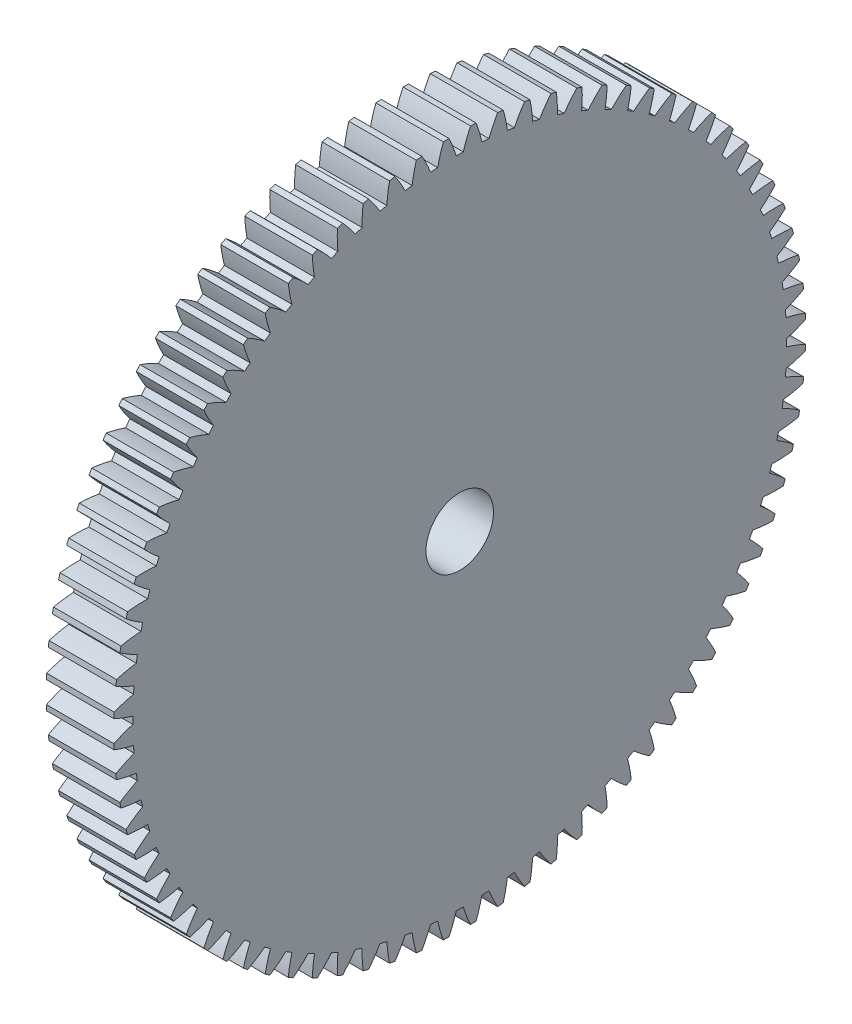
SolidWorks part; units mm, degrees
ref_plane "Plane1" through (0, 0, 0) normal (0, 0, 1) x (1, 0, 0)
ref_plane "Plane2" through (0, 0, 0) normal (0, 1, 0) x (1, 0, 0)
ref_plane "Plane3" through (0, 0, 0) normal (1, 0, 0) x (0, 0, -1)
sketch "HoldingSke" plane through (0, 0, 0) normal (0, 1, 0) x (1, 0, 0)
  line L0 (0, 0) -> (0.3473, -1.9696)
  line L1 (-15, 0) -> (100, 0) construction
  line L2 (0, 0) -> (-2.1039, 2.3779)
  line L3 (0, 0) -> (-11.863, 4.5341)
  line L4 (0, 0) -> (1.4996, 8.5048)
  line L5 (0, 0) -> (-46.8476, -17.4728)
  line L6 (0, 0) -> (-3.3159, -2.2372)
  line L7 (-2.1039, 2.3779) -> (8.6586, 51.2059)
  line L8 (-76.2, 54.61) -> (-75.5, 54.61)
  line L9 (-71.009, 38.7566) -> (-53.1078, 45.2721)
  line L10 (-76.2, 71.12) -> (104.1128, 71.12)
  line L11 (0, 0) -> (-4, 0)
  line L12 (-76.2, 101.6) -> (-76.181, 101.6)
  line L13 (24.9733, 27.94) -> (52.9518, 28.4284)
  line L14 (24.9733, 27.94) -> (24.9743, 27.94)
  line L15 (24.9733, 27.94) -> (100.4006, 29.5858)
  line L16 (-63.627, -0.5) -> (-12.827, -0.5)
  circle A0 centre (0, 0) radius 2
  circle A1 centre (0, 0) radius 19.374
  circle A2 centre (0, 0) radius 37.5
  circle A3 centre (0, 0) radius 2
sketch "BasProSke" plane through (0, 0, 0) normal (0, 1, 0) x (1, 0, 0)
  line L0 (-10, 0) -> (60, 0) construction
  line L1 (0, 0) -> (0, 20.5)
  line L2 (0, 0) -> (4, 0)
  line L3 (4, 0) -> (4, 20.5)
  line L4 (4, 20.5) -> (0, 20.5)
revolve "Base-Revolve" add sketch "BasProSke" angle 360 about L0
sketch "TooCutSke" plane through (0, 0, 0) normal (1, 0, 0) x (0, 0, -1)
  line L1 (0, 0) -> (0, 107) construction
  line L2 (0, 0) -> (-0.4259, 19.9955) construction
  line L3 (0, 0) -> (-1.5701, 39.9627) construction
  line L4 (-0.4259, 19.9955) -> (-0.7851, 19.9814) construction
  arc A0 (0.2101, 19.3729) -> (-0.2101, 19.3729) centre (0, 0) ccw
  arc A1 (0.6519, 20.515) -> (-0.6519, 20.515) centre (0, 0) ccw
  circle A2 centre (0, 0) radius 20 construction
  circle A3 centre (0, 0) radius 18.7939 construction
  arc A4 (-0.2101, 19.3729) -> (-0.6519, 20.515) centre (-7.8705, 17.0665) ccw
  arc A5 (0.6519, 20.515) -> (0.2101, 19.3729) centre (7.8705, 17.0665) ccw
extrude "ToothCut" cut sketch "TooCutSke" along normal through all
fillet "Breaks" [suppressed] radius 0.01
fillet "RootFillets" [suppressed] radius 0.126
pattern_circular "TeethCuts" count 80 every 4.5 about axis through (-10, 0, 0) along (1, 0, 0) of "ToothCut", "RootFillets", "Breaks"
sketch "HubNeaOneSke" plane through (0, 0, 0) normal (-1, 0, 0) x (0, 0, 1)
  circle A0 centre (0, 0) radius 19.374
extrude "HubNearOne" [suppressed] add sketch "HubNeaOneSke" along normal blind 46.0001
sketch "HubNeaBotSke" plane through (0, 0, 0) normal (-1, 0, 0) x (0, 0, 1)
  circle A0 centre (0, 0) radius 19.374
extrude "HubNearBoth" [suppressed] add sketch "HubNeaBotSke" along normal blind 23
ref_plane "FarPln" through (4, 0, 0) normal (1, 0, 0) x (0, 0, -1)
sketch "HubFarSke" plane through (4, 0, 0) normal (1, 0, 0) x (0, 0, -1)
  circle A0 centre (0, 0) radius 19.374
extrude "HubFar" [suppressed] add sketch "HubFarSke" along normal blind 23
sketch "BorSke" plane through (0, 0, 0) normal (1, 0, 0) x (0, 0, -1)
  circle A0 centre (0, 0) radius 2
extrude "Bore" cut sketch "BorSke" along normal mid plane 100.0001
sketch "KeySke" plane through (0, 0, 0) normal (1, 0, 0) x (0, 0, -1)
  line L0 (-0.8, 0) -> (-0.8, 2.7)
  line L1 (-0.8, 2.7) -> (0.8, 2.7)
  line L2 (0.8, 2.7) -> (0.8, 0)
  line L3 (0, 0) -> (0, 34) construction
  line L4 (-0.8, 0) -> (0.8, 0)
extrude "Keyway" [suppressed] cut sketch "KeySke" along normal mid plane 100.0001
pattern_circular "Keyway2" [suppressed] count 2 every 90 about axis through (-10, 0, 0) along (1, 0, 0)
equation "' \"Module@HoldingSke\" = 6.35"
equation "' \"Num_teeth@HoldingSke\" = 12"
equation "' \"Ap@HoldingSke\" =  20"
equation "' \"Ap@HoldingSke\" = 20"
equation "' \"Width@HoldingSke\" = 0.5 * 25.4"
equation "' \"Hub_dia@HoldingSke\"= 1 * 25.4"
equation "' \"Hub_dia@HoldingSke\" = 1 * 25.4"
equation "' \"Overall_len@HoldingSke\" = 1.0 * 25.4"
equation "' \"Bore@HoldingSke\" = 0.75 * 25.4"
equation "' \"T_dim@HoldingSke\" = 0.1 * 25.4"
equation "' \"Width@KeySke\" = 0.25 * 25.4"
equation "' \"Show_teeth@HoldingSke\" = 13"
equation "' \"Backlash@HoldingSke\" = 0.009 * 25.4"
equation "' \"Addendum_fac@HoldingSke\" = 1.0"
equation "' \"Dedendum_fac@HoldingSke\" = 1.25"
equation "' \"Dedendum_add@HoldingSke\" = 0.00005 * 25.4"
equation "' \"Clearance_fac@HoldingSke\" = 0.25"
equation "\"Pitch@HoldingSke\" = 1 / \"Module@HoldingSke\""
equation "\"Overcut_dia@TooCutSke\" = (\"Num_teeth@HoldingSke\" + 2 * \"Addendum_fac@HoldingSke\") / \"Pitch@HoldingSke\" + 0.002 * 25.4"
equation "\"Pitch_dia@TooCutSke\" = \"Num_teeth@HoldingSke\" / \"Pitch@HoldingSke\""
equation "\"Base_dia@TooCutSke\" = \"Num_teeth@HoldingSke\" / \"Pitch@HoldingSke\" * cos((\"Ap@HoldingSke\"  * 3.14159265 / 180))"
equation "\"Root_dia@TooCutSke\" = (\"Num_teeth@HoldingSke\" + 2) / \"Pitch@HoldingSke\" - 2 * (\"Addendum_fac@HoldingSke\" + \"Dedendum_fac@HoldingSke\") / \"Pitch@HoldingSke\" - \"Dedendum_add@HoldingSke\" * 2"
equation "\"Half_ang@TooCutSke\" = 180 / \"Num_teeth@HoldingSke\""
equation "\"Half_CT@TooCutSke\" = \"Num_teeth@HoldingSke\" / \"Pitch@HoldingSke\" * sin((3.14159265 / 2 / \"Num_teeth@HoldingSke\")) / 2 - 7 * \"Backlash@HoldingSke\" / 4"
equation "\"Flank_rad@TooCutSke\" = \"Num_teeth@HoldingSke\" / \"Pitch@HoldingSke\" / 5"
equation "\"Radius@RootFillets\" = \"Clearance_fac@HoldingSke\" / \"Pitch@HoldingSke\" + \"Dedendum_add@HoldingSke\""
equation "\"Break_rad@Breaks\" = 0.02 / \"Pitch@HoldingSke\""
equation "\"Thickness@HoldingSke\" = \"Width@HoldingSke\""
equation "\"OAL@HoldingSke\" = \"Thickness@HoldingSke\""
equation "\"MHD@HoldingSke\" = (\"Num_teeth@HoldingSke\" + 2) / \"Pitch@HoldingSke\" - 2 * (\"Addendum_fac@HoldingSke\" + \"Dedendum_fac@HoldingSke\")  / \"Pitch@HoldingSke\" - \"Dedendum_add@HoldingSke\" * 2"
equation "\"MBD@HoldingSke\" = (\"Num_teeth@HoldingSke\" + 2) / \"Pitch@HoldingSke\" - 2 * (\"Addendum_fac@HoldingSke\" + \"Dedendum_fac@HoldingSke\")  / \"Pitch@HoldingSke\" - \"Dedendum_add@HoldingSke\" * 2 - 0.002 * 25.4"
equation "\"MHD@HoldingSke\" = ((sgn( \"MHD@HoldingSke\" - \"Hub_dia@HoldingSke\" )-1)*( \"MHD@HoldingSke\" - \"Hub_dia@HoldingSke\" ))/-2+ \"Hub_dia@HoldingSke\""
equation "\"MBD@HoldingSke\" = ((sgn( \"MBD@HoldingSke\" - \"Bore@HoldingSke\" )-1)*( \"MBD@HoldingSke\" - \"Bore@HoldingSke\" ))/-2+ \"Bore@HoldingSke\""
equation "\"OAL@HoldingSke\" = ((sgn( \"OAL@HoldingSke\" - \"Overall_len@HoldingSke\" )+1)*( \"OAL@HoldingSke\" - \"Overall_len@HoldingSke\" ))/2 + \"Overall_len@HoldingSke\" + 0.000002 * 25.4"
equation "\"Num_teeth@TeethCuts\" = int( \"Show_teeth@HoldingSke\" ) + 1"
equation "\"Num_teeth@TeethCuts\" = ((sgn( \"Num_teeth@TeethCuts\" - \"Num_teeth@HoldingSke\" )-1)*( \"Num_teeth@TeethCuts\" - \"Num_teeth@HoldingSke\" ))/-2+ \"Num_teeth@HoldingSke\""
equation "\"Num_teeth@TeethCuts\" = ((sgn( \"Num_teeth@TeethCuts\" - 2.0)+1)*( \"Num_teeth@TeethCuts\" - 2.0))/2 +2.0"
equation "\"Angle@TeethCuts\" = 360.0 / \"Num_teeth@HoldingSke\""
equation "\"Diameter@BasProSke\" = (\"Num_teeth@HoldingSke\" + 2 * \"Addendum_fac@HoldingSke\") / \"Pitch@HoldingSke\""
equation "\"Thickness@BasProSke\"  = \"Thickness@HoldingSke\""
equation "' \"Fillet_rad@BasProSke\" =  \"Thickness@HoldingSke\" * 0.05"
equation "' \"Fillet_rad@BasProSke\" = \"Thickness@HoldingSke\" * 0.05"
equation "\"MHD@HoldingSke\" = ((sgn( \"MHD@HoldingSke\" - \"Root_dia@TooCutSke\" )-1)*( \"MHD@HoldingSke\" - \"Root_dia@TooCutSke\" ))/-2+ \"Root_dia@TooCutSke\""
equation "\"Diameter@HubNeaOneSke\" = \"MHD@HoldingSke\""
equation "\"Length@HubNearOne\" = \"OAL@HoldingSke\" - \"Thickness@BasProSke\""
equation "\"Diameter@HubNeaBotSke\" = \"MHD@HoldingSke\""
equation "\"Length@HubNearBoth\" = ( \"OAL@HoldingSke\" - \"Thickness@BasProSke\" ) / 2.0"
equation "\"Thickness@FarPln\" = \"Thickness@BasProSke\""
equation "\"Diameter@HubFarSke\" = \"MHD@HoldingSke\""
equation "\"Length@HubFar\" = ( \"OAL@HoldingSke\" - \"Thickness@BasProSke\" ) / 2.0"
equation "\"Diameter@BorSke\" = \"MBD@HoldingSke\""
equation "\"D1@Bore\" = \"OAL@HoldingSke\" * 2.0"
equation "\"D1@Keyway\" = \"OAL@HoldingSke\" * 2.0"
equation "\"Offset@KeySke\" = \"T_dim@HoldingSke\" + \"MBD@HoldingSke\" / 2.0"
